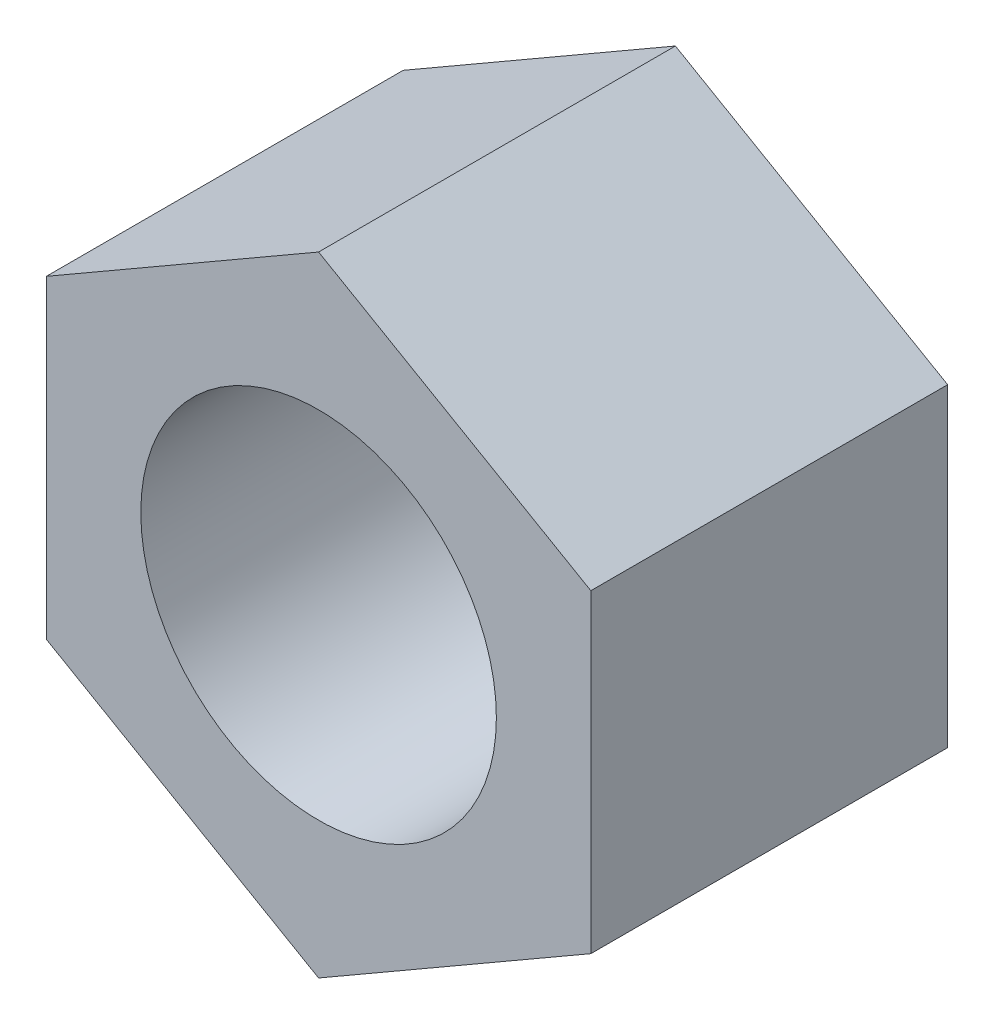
SolidWorks part; units mm, degrees
ref_plane "Front Plane" through (0, 0, 0) normal (1, 0, 0) x (0, 1, 0)
ref_plane "Top Plane" through (0, 0, 0) normal (0, 0, 1) x (0, 1, 0)
ref_plane "Right Plane" through (0, 0, 0) normal (0, 1, 0) x (-1, 0, 0)
sketch "Sketch1" plane through (0, 0, 0) normal (0, 0, 1) x (0, 1, 0)
  point P0 (0, 0)
  line B0 (89.8213, 0) -> (44.9106, 77.7875)
  line B1 (44.9106, 77.7875) -> (-44.9106, 77.7875)
  line B2 (-44.9106, 77.7875) -> (-89.8213, 0)
  line B3 (-89.8213, 0) -> (-44.9106, -77.7875)
  line B4 (-44.9106, -77.7875) -> (44.9106, -77.7875)
  line B5 (44.9106, -77.7875) -> (89.8213, 0)
  circle B6 centre (0, 0) radius 77.7875 construction
  circle B7 centre (0, 0) radius 50.8
sketch_block_instance "4in Nut-1"
sketch_block "4in Nut" parameters "D1"=155.575, "D2"=101.6
extrude "Nut body" add sketch "Sketch1" along normal blind 101.9556
